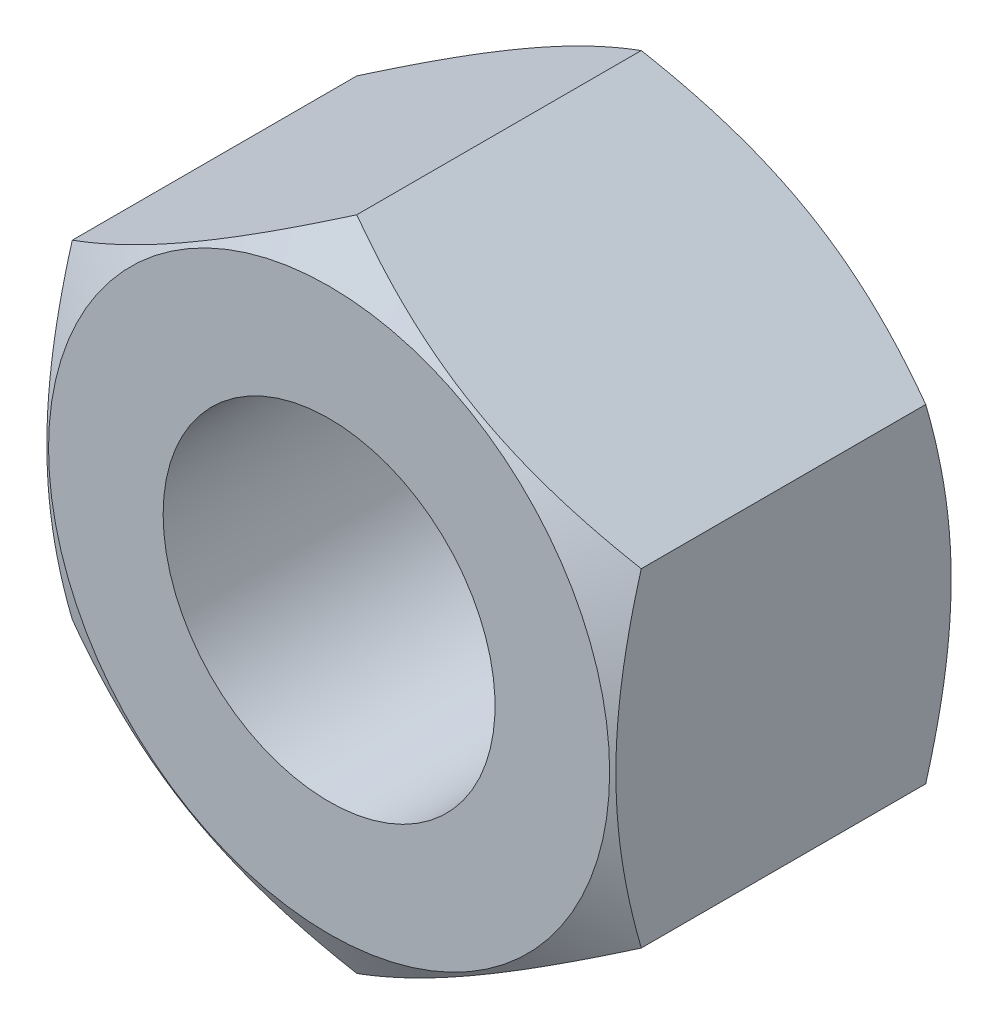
SolidWorks part; units mm, degrees
ref_plane "Face" through (0, 0, 0) normal (0, 0, 1) x (1, 0, 0)
ref_plane "Coté" through (0, 0, 0) normal (0, 1, 0) x (1, 0, 0)
ref_plane "Dessus" through (0, 0, 0) normal (1, 0, 0) x (0, 0, -1)
sketch "Esquisse1" plane through (0, 0, 0) normal (0, 0, 1) x (1, 0, 0)
  line L1 (18, 10.3923) -> (0, 20.7846)
  line L2 (0, 20.7846) -> (-18, 10.3923)
  line L3 (-18, 10.3923) -> (-18, -10.3923)
  line L4 (-18, -10.3923) -> (0, -20.7846)
  line L5 (0, -20.7846) -> (18, -10.3923)
  line L6 (18, -10.3923) -> (18, 10.3923)
  circle A0 centre (0, 0) radius 18 construction
  dimension "D1" = 36
extrude "Base-Extrusion" add sketch "Esquisse1" along normal blind 21.5
sketch "Esquisse4" plane through (0, 0, 0) normal (1, 0, 0) x (0, 0, -1)
  line L0 (-1.752, 20.7846) -> (0, 20.7846)
  line L1 (-21.5, 20.7846) -> (0, 20.7846) construction
  line L2 (0, 20.7846) -> (0, 17.75)
  line L3 (0, 17.75) -> (-1.752, 20.7846)
  line L4 (2.7645, 0) -> (-11.5815, 0) construction
  line L5 (-21.5, 20.7846) -> (-19.748, 20.7846)
  line L6 (-19.748, 20.7846) -> (-21.5, 17.75)
  line L7 (-21.5, 10.3923) -> (-21.5, 20.7846) construction
  line L8 (-21.5, 17.75) -> (-21.5, 20.7846)
  dimension "D1" = 35.5
  dimension "D2" = 30
revolve "Enlèvement de matière-Révolution1" cut sketch "Esquisse4" angle 360 about L4
hole_wizard "Trou taraudé M241" positions "Esquisse3D1" profile "Esquisse5" tap size "M24" standard "ISO"
sketch3d "Esquisse3D1"
  point P0 (0, 0, 0)
sketch "Esquisse5" plane through (0, 0, 0) normal (1, 0, 0) x (0, 1, 0)
  line L0 (0, 0) -> (0, 21.5)
  line L1 (0, 21.5) -> (10.5, 21.5)
  line L2 (10.5, 21.5) -> (10.5, 0)
  line L5 (10.5, 0) -> (0, 0)
  line L11 (0, -6.35) -> (0, 107.95) construction
  dimension "Diamètre du trou pour taraudage jusqu'au prochain" = 21
  dimension "Profondeur du trou pour taraudage jusqu'au prochain" = 21.5
